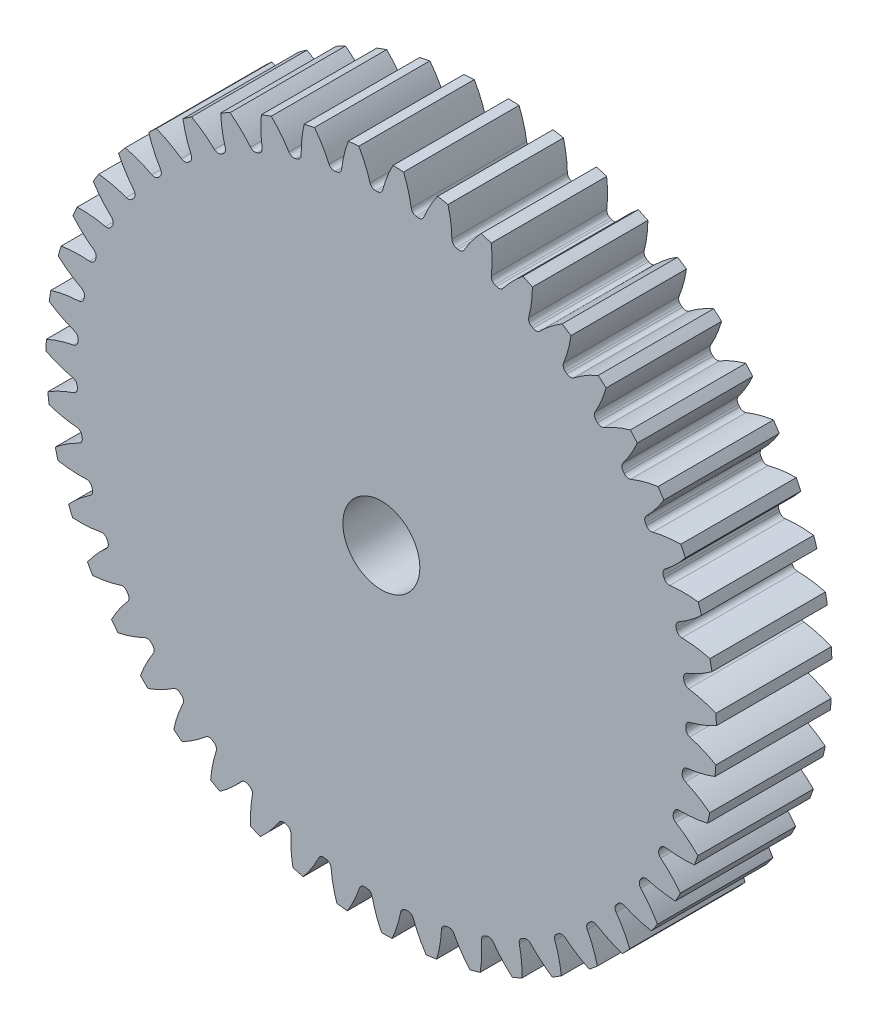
SolidWorks part; units mm, degrees
ref_plane "Front" through (0, 0, 0) normal (0, 0, 1) x (1, 0, 0)
ref_plane "Top" through (0, 0, 0) normal (0, 1, 0) x (1, 0, 0)
ref_plane "Right" through (0, 0, 0) normal (1, 0, 0) x (0, 0, -1)
sketch "Sketch3" plane through (0, 0, 0) normal (0, 0, 1) x (1, 0, 0)
  circle A0 centre (0, 0) radius 276.5778
  dimension "od" = 553.1556
extrude "gearBody" add sketch "Sketch3" along normal blind 95.25
sketch "Sketch2" plane through (0, 0, 0) normal (0, 0, 1) x (1, 0, 0)
  line L0 (0, 0) -> (230.3139, 95.3992) construction
  line L1 (276.0875, -18.9806) -> (0, 0) construction
  line L2 (0, 0) -> (36.3143, 0) construction
  line L3 (265.2547, 4.2586) -> (264.9502, -13.4011) construction
  line L5 (265.1024, -4.5713) -> (0, 0) construction
  line L7 (0, 0) -> (249.29, 0) construction
  arc A0 (249.2898, -0.3473) -> (249.1535, -8.2476) centre (0, 0) ccw construction
  arc A1 (276.4192, 9.3656) -> (275.9319, -18.89) centre (0, 0) ccw construction
  arc A2 (265.2547, 4.2586) -> (264.9502, -13.4011) centre (0, 0) ccw construction
  arc A3 (251.1253, -5.1364) -> (251.153, -3.5246) centre (0, 0) ccw
  arc A4 (276.0875, -18.9806) -> (254.4228, -9.6383) centre (226.888, -103.2829) ccw
  arc A5 (276.0875, -18.9806) -> (276.5778, 9.4508) centre (0, 0) ccw
  arc A6 (276.5778, 9.4508) -> (254.6038, 0.861) centre (230.3139, 95.3992) cw
  arc A7 (251.153, -3.5246) -> (254.6038, 0.861) centre (255.7472, -3.589) cw
  arc A8 (254.4228, -9.6383) -> (251.1253, -5.1364) centre (255.7189, -5.2304) cw
  point P6 (276.5778, 9.4508)
  point P22 (276.0875, -18.9806)
  dimension "baseDia" = 498.58
  dimension "od" = 553.1556
  dimension "pd" = 530.5778
  dimension "rd" = 502.3556
  dimension "rFillet" = 4.5946
  dimension "pointX" = 276.5778
  dimension "pointY" = 9.4508
  dimension "CTT" = 17.6597
  dimension "flankCenterAngle" = 22.5
extrude "toothCut" cut sketch "Sketch2" along normal through all
pattern_circular "CirPattern1" count 47 over 360 about axis through (0, 0, 0) along (0, 0, 1) of "toothCut"
sketch "hub1Dia" plane through (0, 0, 0) normal (0, 0, -1) x (-1, 0, 0)
  circle A0 centre (0, 0) radius 12.7
  dimension "hub1Dia" = 25.4
sketch "hub2Dia" plane through (0, 0, 95.25) normal (0, 0, 1) x (1, 0, 0)
  circle A0 centre (0, 0) radius 12.7
  dimension "hub2dia" = 25.4
sketch "boreDia" plane through (0, 0, 0) normal (0, 0, 1) x (1, 0, 0)
  circle A0 centre (0, 0) radius 31.75
  dimension "boreDia" = 63.5
extrude "bore" cut sketch "boreDia" against normal mid plane 25400
